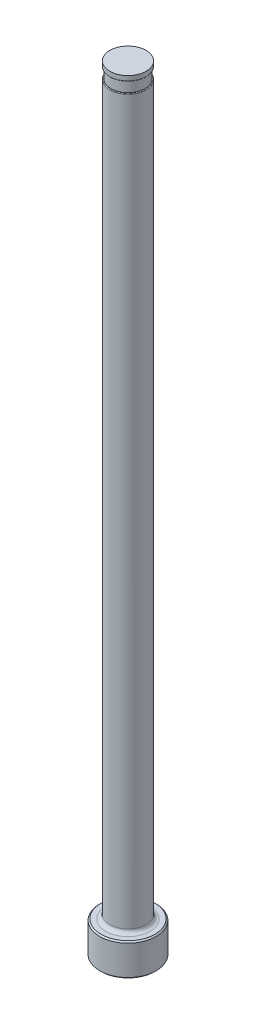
SolidWorks part; units mm, degrees
ref_plane "Front Plane" through (0, 0, 0) normal (0, 0, 1) x (1, 0, 0)
ref_plane "Top Plane" through (0, 0, 0) normal (0, 1, 0) x (1, 0, 0)
ref_plane "Right Plane" through (0, 0, 0) normal (1, 0, 0) x (0, 0, -1)
other "Configuration Table"
sketch "Sketch1" plane through (0, 0, 0) normal (0, 0, 1) x (1, 0, 0)
  line L0 (0, 259.9588) -> (0, -15.1925) construction
  line L1 (0, 0) -> (-5.5499, 0)
  line L2 (-5.5499, 0) -> (-5.5499, 6.35)
  line L3 (-5.5499, 6.35) -> (-3.5712, 6.35)
  line L4 (-3.5712, 6.35) -> (-3.5712, 152.4)
  line L5 (-3.5712, 152.4) -> (0, 152.4)
  line L6 (0, 152.4) -> (0, 0)
  dimension "L" = 152.4
  dimension "H" = 11.0998
  dimension "T" = 6.35
  dimension "D" = 7.1425
revolve "Revolve1" add sketch "Sketch1" angle 360 about L0
chamfer "Chamfer1" distance 0.254 angle 45 2 edges at (0, 6.35, 5.5499) (0, 0, 5.5499)
fillet "Fillet1" radius 0.762 1 edges at (0, 6.35, 3.5712)
sketch "Sketch2" plane through (0, 0, 0) normal (0, 0, 1) x (1, 0, 0)
  line L0 (-3.5712, 152.4) -> (-3.5712, 7.112) construction
  line L1 (-3.5712, 151.384) -> (-3.368, 151.384)
  line L2 (-3.5712, 151.384) -> (-3.5712, 149.352)
  line L3 (-3.5712, 149.352) -> (-3.368, 149.352)
  line L4 (-3.368, 151.384) -> (-3.368, 149.352)
  line L5 (3.5712, 152.4) -> (-3.5712, 152.4) construction
  line L6 (0, 153.4483) -> (0, 147.3282) construction
  dimension "D1" = 2.032
  dimension "N" = 1.016
  dimension "FD" = 0.2032
  dimension "D3" = 6.7361
revolve "Vent Relief" cut sketch "Sketch2" angle 360 about L6
sketch "Sketch3" plane through (0, 0, 0) normal (0, 0, 1) x (1, 0, 0)
  line L0 (-3.368, 150.368) -> (-3.368, 86.868)
  line L1 (-3.368, 151.384) -> (-3.368, 149.352) construction
  line L2 (-3.5712, 149.352) -> (-3.5712, 7.112) construction
  line L3 (-3.5712, 85.7504) -> (-3.5712, 150.368)
  line L4 (-3.5712, 150.368) -> (-3.368, 150.368)
  arc A0 (-3.368, 86.868) -> (-3.5712, 85.7504) centre (-6.543, 86.868) cw
  dimension "D1" = 3.175
  dimension "D2" = 63.5
extrude "D-Slot" cut sketch "Sketch3" against normal through all both and the other way through all
sketch "Sketch5" plane through (0, 0, 0) normal (0, 0, 1) x (1, 0, 0)
  line L0 (-3.5712, 151.384) -> (3.5712, 151.384) construction
  line L1 (-3.5712, 152.4) -> (-3.5662, 152.4)
  line L2 (-3.5712, 152.4) -> (-3.5712, 151.384)
  line L3 (-3.5712, 151.384) -> (-3.5662, 151.384)
  line L4 (-3.5662, 152.4) -> (-3.5662, 151.384)
  line L5 (0, 152.6877) -> (0, 150.5771) construction
  dimension "VP" = 0.0051
revolve "Vent Diameter" cut sketch "Sketch5" angle 360 about L5
fillet "Fillet2" radius 0.127 2 edges at (3.5712, 149.352, 0) (0, 151.384, 3.5662)
sketch "Pocket Sketch" plane through (0, 0, 0) normal (0, 0, 1) x (1, 0, 0)
  line L0 (-5.9468, 0) -> (-5.9468, 6.3754)
  line L1 (-5.9468, 6.3754) -> (-4.5317, 6.3754)
  line L2 (-3.7697, 7.1374) -> (-3.7697, 22.225)
  line L3 (-3.7697, 22.225) -> (0, 22.225)
  line L4 (0, 22.225) -> (0, 0)
  line L5 (0, 0) -> (-5.9468, 0)
  line L6 (0, 12.6104) -> (0, -2.4989) construction
  line L7 (-5.5499, 6.096) -> (-5.5499, 0.254) construction
  line L8 (5.2959, 6.35) -> (-5.2959, 6.35) construction
  line L9 (-3.5712, 85.7504) -> (-3.5712, 7.112) construction
  line L10 (-4.5317, 6.3754) -> (-3.7697, 7.1374)
  point P3 (-3.7697, 6.3754)
  dimension "D1" = 11.8935
  dimension "D2" = 0.3969
  dimension "D3" = 0.0254
  dimension "D4" = 0.1984
  dimension "D5" = 7.5394
  dimension "D6" = 22.225
